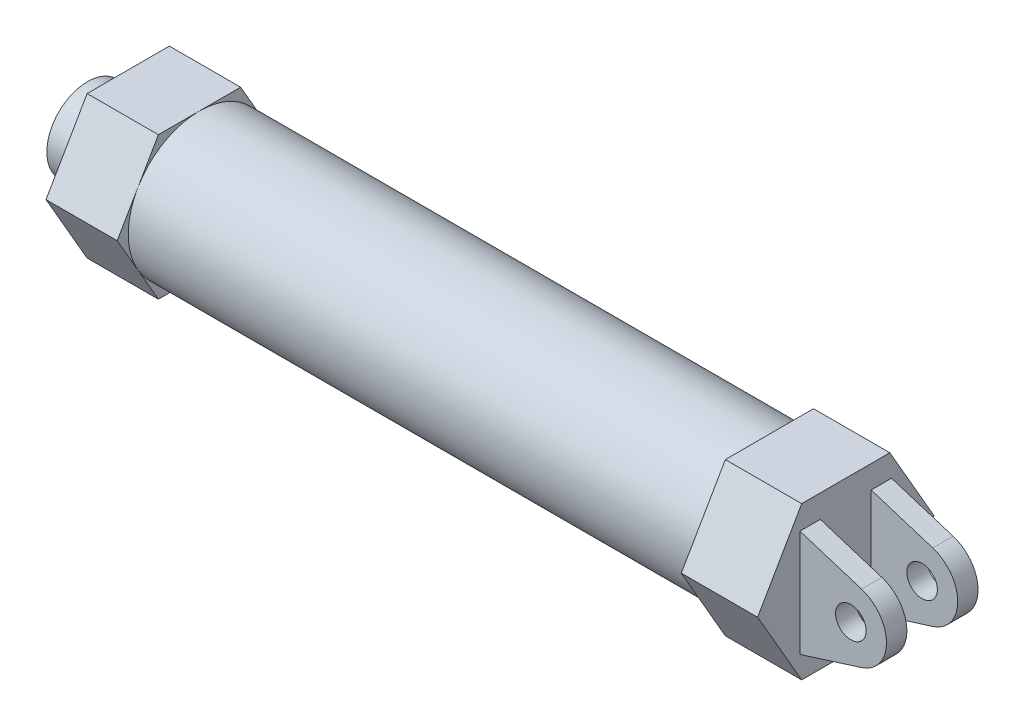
SolidWorks part; units mm, degrees
ref_plane "front" through (0, 0, 0) normal (0, 0, 1) x (1, 0, 0)
ref_plane "top" through (0, 0, 0) normal (0, 1, 0) x (1, 0, 0)
ref_plane "side" through (0, 0, 0) normal (1, 0, 0) x (0, 0, -1)
sketch "Sketch1"
  dimension "D1" = 95.25
  dimension "D2" = 95.25
extrude "Base-Extrude" add sketch "Sketch1" against normal blind 47.625
sketch "Sketch2"
  dimension "D1" = 88.9
extrude "Boss-Extrude1" add sketch "Sketch2" along normal blind 355.6
sketch "Sketch3"
  dimension "D1" = 0
extrude "Boss-Extrude2" add sketch "Sketch3" along normal blind 44.45
sketch "Sketch4"
  dimension "D1" = 50.8
extrude "Boss-Extrude3" add sketch "Sketch4" along normal blind 25.4
sketch "Sketch5"
  dimension "D1" = 34.925
extrude "Cut-Extrude1" cut sketch "Sketch5" against normal up to surface (425.45 mm away)
sketch "Sketch6"
  dimension "D3" = 19.05
  dimension "D4" = 22.225
  dimension "D1" = 35
  dimension "D2" = 31.75
extrude "Boss-Extrude4" add sketch "Sketch6" along normal mid plane 57.15
sketch "Sketch7"
  dimension "D1" = 31.75
extrude "Cut-Extrude2" cut sketch "Sketch7" against normal through all
